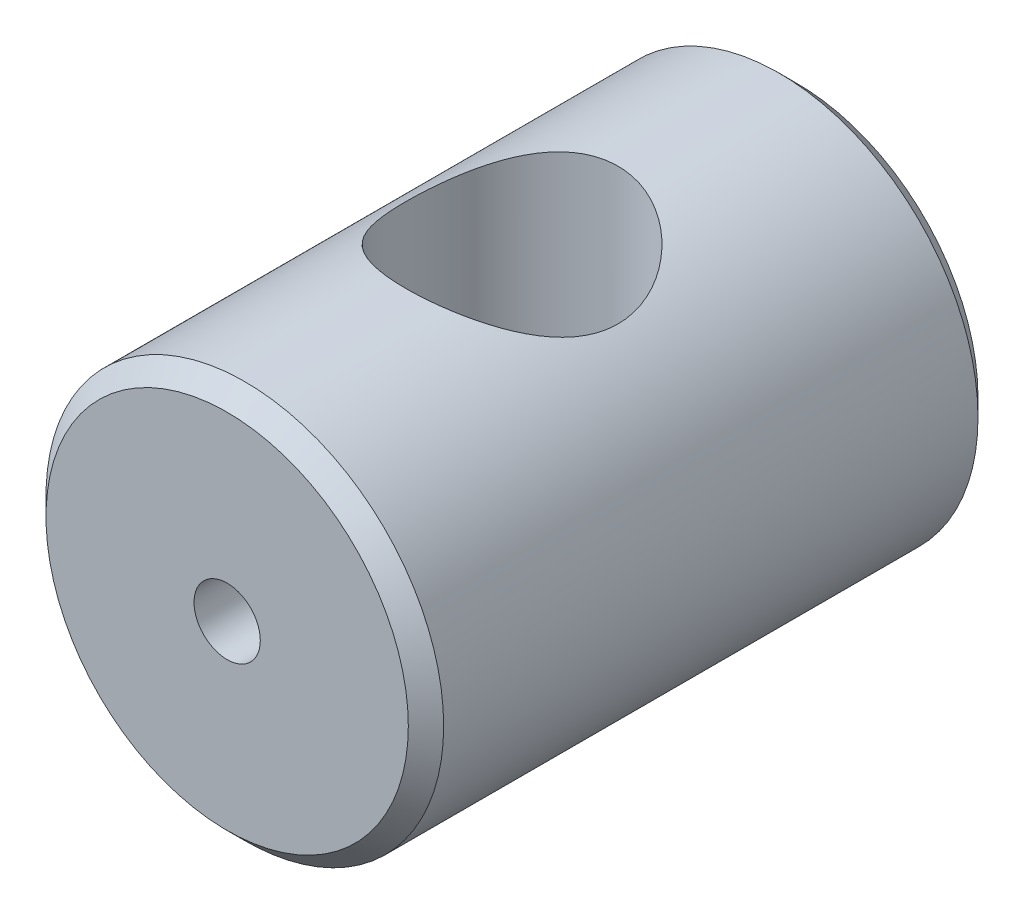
SolidWorks part; units mm, degrees
ref_plane "Plan de face" through (0, 0, 0) normal (0, 0, 1) x (1, 0, 0)
ref_plane "Plan de dessus" through (0, 0, 0) normal (0, 1, 0) x (1, 0, 0)
ref_plane "Plan de droite" through (0, 0, 0) normal (1, 0, 0) x (0, 0, -1)
sketch "Esquisse1" plane through (0, 0, 0) normal (1, 0, 0) x (0, 0, -1)
  line L0 (0, 0) -> (75.3365, 0) construction
  line L1 (0, 3.75) -> (0, 20.5)
  line L2 (2, 22.5) -> (62.4658, 22.5)
  line L3 (64.4658, 20.5) -> (64.4658, 3.75)
  line L4 (0, 20.5) -> (2, 22.5)
  line L5 (62.4658, 22.5) -> (64.4658, 20.5)
  line L6 (0, 3.75) -> (64.4658, 3.75)
  point P4 (0, 22.5)
  point P5 (64.4658, 22.5)
  dimension "D1" = 45
  dimension "D4" = 2
  dimension "D5" = 2
  dimension "D2" = 7.5
revolve "Révolution1" add sketch "Esquisse1" angle 360 about L0
sketch "Esquisse2" plane through (0, 0, 0) normal (0, 1, 0) x (1, 0, 0)
  line L0 (0, 64.4658) -> (0, 0) construction
  line L1 (20.5, 64.4658) -> (-20.5, 64.4658) construction
  line L2 (22.5, 32.2329) -> (-22.5, 32.2329) construction
  line L3 (22.5, 2) -> (22.5, 62.4658) construction
  line L4 (-22.5, 62.4658) -> (-22.5, 2) construction
  circle A0 centre (0, 32.2329) radius 12
  dimension "D1" = 24
extrude "Extrusion1" cut sketch "Esquisse2" against normal mid plane 60
